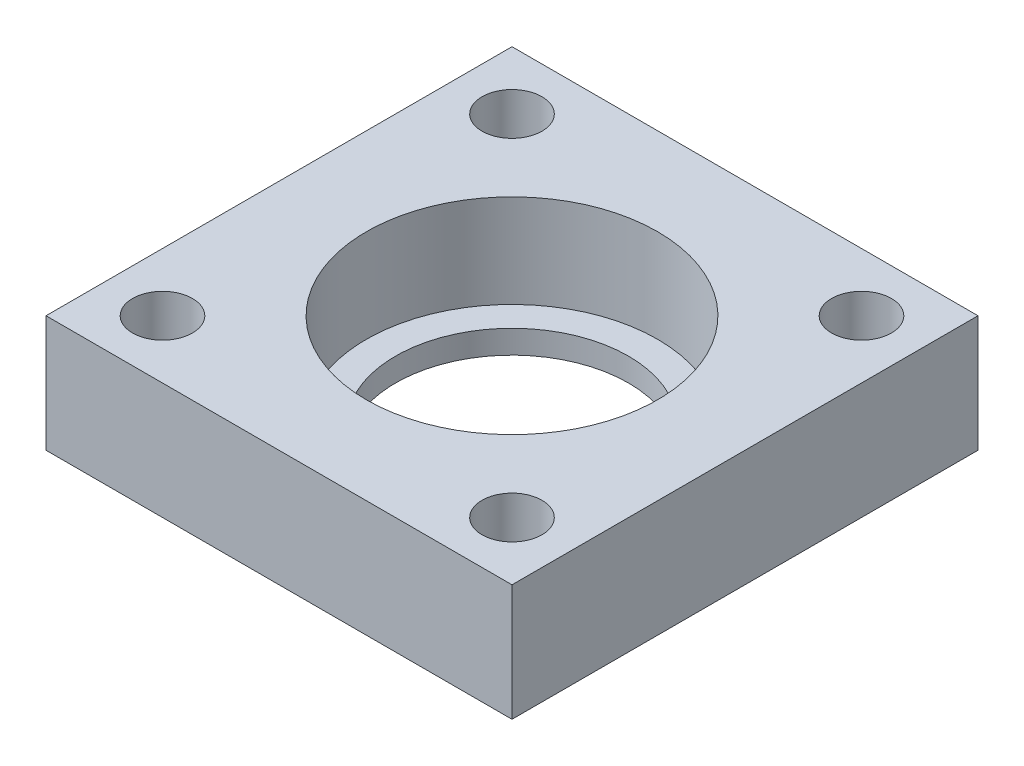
SolidWorks part; units mm, degrees
ref_plane "Front Plane" through (0, 0, 0) normal (0, 0, 1) x (1, 0, 0)
ref_plane "Top Plane" through (0, 0, 0) normal (0, 1, 0) x (1, 0, 0)
ref_plane "Right Plane" through (0, 0, 0) normal (1, 0, 0) x (0, 0, -1)
sketch "Sketch1" plane through (0, 0, 0) normal (0, 1, 0) x (1, 0, 0)
  line L1 (0, 0) -> (25.4, 0)
  line L2 (0, 0) -> (0, 25.4)
  line L3 (0, 25.4) -> (25.4, 25.4)
  line L4 (25.4, 0) -> (25.4, 25.4)
  dimension "D1" = 25.4
  dimension "D2" = 25.4
extrude "Extrude1" add sketch "Sketch1" against normal blind 6.35
sketch "Sketch2" plane through (0, 0, 0) normal (0, 1, 0) x (-1, 0, 0)
  line L0 (0, 0) -> (-25.4, -25.4) construction
  circle A0 centre (-12.7, -12.7) radius 7.9375
  dimension "D1" = 15.875
extrude "Extrude2" cut sketch "Sketch2" against normal blind 5.08
sketch "Sketch3" plane through (0, -5.08, 0) normal (0, 1, 0) x (-1, 0, 0)
  circle A0 centre (-12.7, -12.7) radius 6.35
  circle A1 centre (-12.7, -12.7) radius 7.9375 construction
  dimension "D1" = 12.7
extrude "Extrude3" cut sketch "Sketch3" against normal up to surface (1.27 mm away)
hole_wizard "#4 Clearance Hole1" positions "3DSketch1" profile "Sketch4" hole size "#4" standard "Ansi Inch"
sketch3d "3DSketch1"
  line L0 (0, 0, -25.4) -> (25.4, 0, 0) construction
  line L2 (0, 0, -25.4) -> (0, 0, 0) construction
  line L3 (25.4, 0, -25.4) -> (0, 0, -25.4) construction
  point P0 (3.175, 0, -22.225)
  dimension "D1" = 3.175
  dimension "D2" = 3.175
sketch "Sketch4" plane through (3.175, 0, -22.225) normal (1, 0, 0) x (0, 0, 1)
  line L0 (0, 0) -> (0, 10.1246)
  line L1 (0, 10.1246) -> (1.6319, 9.144)
  line L2 (1.6319, 9.144) -> (1.6319, 0)
  line L5 (1.6319, 0) -> (0, 0)
  line L10 (0, 10.1246) -> (-1.632, 9.144) construction
  line L11 (0, -6.35) -> (0, 107.95) construction
  dimension "Hole Dia." = 3.2639
  dimension "Hole Depth" = 9.144
  dimension "Drill Angle" = 118
pattern_circular "CirPattern1" count 4 over 360 about axis through (12.7, 0, -12.7) along (0, 1, 0) of "#4 Clearance Hole1"
